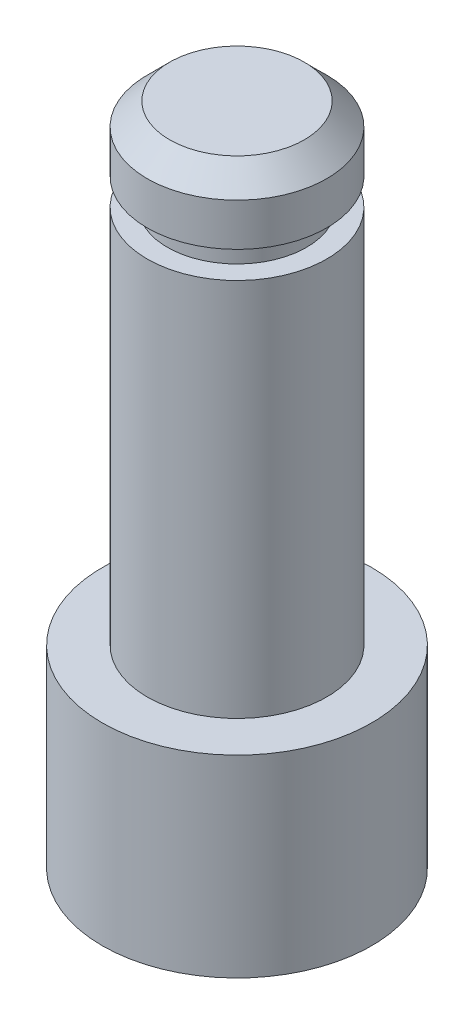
SolidWorks part; units mm, degrees
ref_plane "Face" through (0, 0, 0) normal (0, 0, 1) x (1, 0, 0)
ref_plane "Dessus" through (0, 0, 0) normal (0, 1, 0) x (1, 0, 0)
ref_plane "Droite" through (0, 0, 0) normal (1, 0, 0) x (0, 0, -1)
sketch "Esquisse1" plane through (0, 0, 0) normal (0, 0, 1) x (1, 0, 0)
  line L0 (0, 30.5) -> (0, 0)
  line L1 (0, 0) -> (-6, 0)
  line L2 (-6, 0) -> (-6, 2)
  line L3 (-6, 2) -> (-3, 2)
  line L4 (-3, 2) -> (-3, 20)
  line L5 (-3, 20) -> (-2, 20)
  line L6 (-2, 20) -> (-2, 30.5)
  line L7 (-2, 30.5) -> (0, 30.5)
  line L8 (0, 0) -> (0, -5.4607) construction
  dimension "D1" = 6
  dimension "D2" = 2
  dimension "D3" = 18
  dimension "D5" = 3
  dimension "D6" = 2
  dimension "D7" = 28.5
revolve "Révolution1" add sketch "Esquisse1" angle 360 about L8
chamfer "Chanfrein1" distance 0.5 angle 45
sketch "Esquisse2" plane through (0, 0, 0) normal (0, 0, 1) x (1, 0, 0)
  line L0 (0, 0) -> (0, 8.888) construction
  line L1 (6, 2) -> (-6, 2) construction
  line L2 (-3, 29.05) -> (-1.55, 29.05)
  line L3 (-3, 29.05) -> (-3, 28.45)
  line L4 (-3, 28.45) -> (-1.55, 28.45)
  line L5 (-1.55, 29.05) -> (-1.55, 28.45)
  line L6 (-3, 20) -> (-3, 2) construction
  dimension "D1" = 0.6
  dimension "D2" = 1.55
  dimension "D3" = 26.45
revolve "Enlèvement de matière-Révolution1" cut sketch "Esquisse2" angle 360 about L0
sketch "Esquisse3" plane through (0, 0, 0) normal (0, -1, 0) x (1, 0, 0)
  circle A0 centre (0, 0) radius 6
  circle A1 centre (0, 0) radius 6 construction
extrude "Coupe" cut sketch "Esquisse3" against normal blind 15.7
